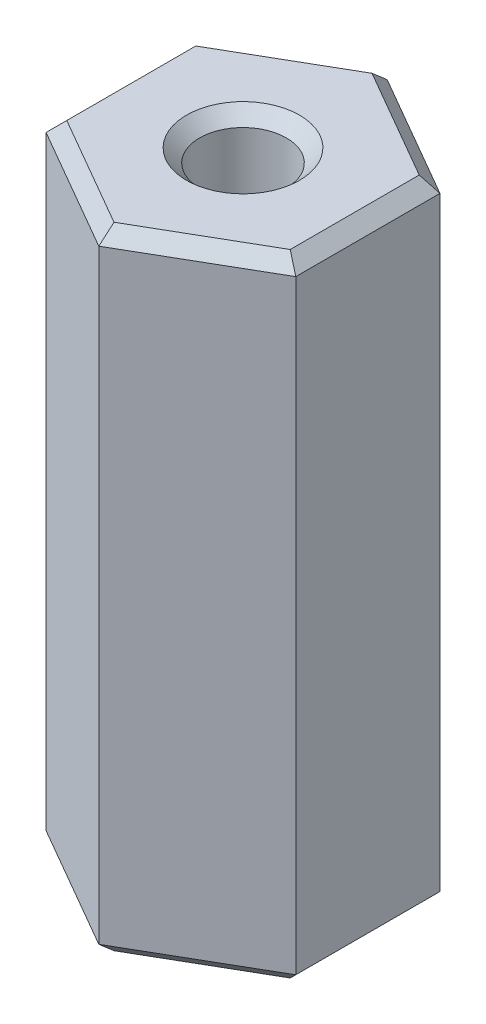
SolidWorks part; units mm, degrees
ref_plane "Plan de face" through (0, 0, 0) normal (0, 0, 1) x (1, 0, 0)
ref_plane "Plan de dessus" through (0, 0, 0) normal (0, 1, 0) x (1, 0, 0)
ref_plane "Plan de droite" through (0, 0, 0) normal (1, 0, 0) x (0, 0, -1)
sketch "Esquisse1" plane through (0, 0, 0) normal (0, 0, 1) x (1, 0, 0)
  line L0 (0, 0) -> (0, 12.4178) construction
  line L1 (-12.925, 0) -> (-2.925, 0)
  line L2 (-2.925, 0) -> (-2.925, 20)
  line L3 (-2.925, 20) -> (0, 22.925)
  line L4 (0, 22.925) -> (0, 24.7)
  line L5 (0, 24.7) -> (-3.3, 28)
  line L6 (-3.3, 28) -> (-3.3, 48)
  line L7 (-3.3, 48) -> (-12.925, 48)
  line L8 (-12.925, 48) -> (-12.925, 0)
  dimension "D1" = 5.85
  dimension "D2" = 6.6
  dimension "D3" = 20
  dimension "D4" = 48
  dimension "D5" = 20
  dimension "D6" = 45
  dimension "D7" = 10
  dimension "D8" = 25.85
revolve "Révolution1" add sketch "Esquisse1" angle 360 about L0
sketch "Esquisse2" plane through (0, 48, 0) normal (0, 1, 0) x (1, 0, 0)
  line L1 (0, 10.9697) -> (-9.5, 5.4848)
  line L2 (-9.5, 5.4848) -> (-9.5, -5.4848)
  line L3 (-9.5, -5.4848) -> (0, -10.9697)
  line L4 (0, -10.9697) -> (9.5, -5.4848)
  line L5 (9.5, -5.4848) -> (9.5, 5.4848)
  line L6 (9.5, 5.4848) -> (0, 10.9697)
  circle A0 centre (0, 0) radius 9.5 construction
  dimension "D1" = 19
extrude "Enlèv. mat.-Extru.1" cut sketch "Esquisse2" against normal through all both and the other way through all flip side to cut
chamfer "Chanfrein1" distance 1 angle 45 14 edges at (0, 0, -2.925) (0, 48, -3.3) (-4.75, 0, -8.2272) (-9.5, 0, 0) (-4.75, 0, 8.2272) (4.75, 0, 8.2272) (9.5, 0, 0) (4.75, 0, -8.2272) (9.5, 48, 0) (4.75, 48, 8.2272) (-4.75, 48, 8.2272) (-9.5, 48, 0) (-4.75, 48, -8.2272) (4.75, 48, -8.2272)
